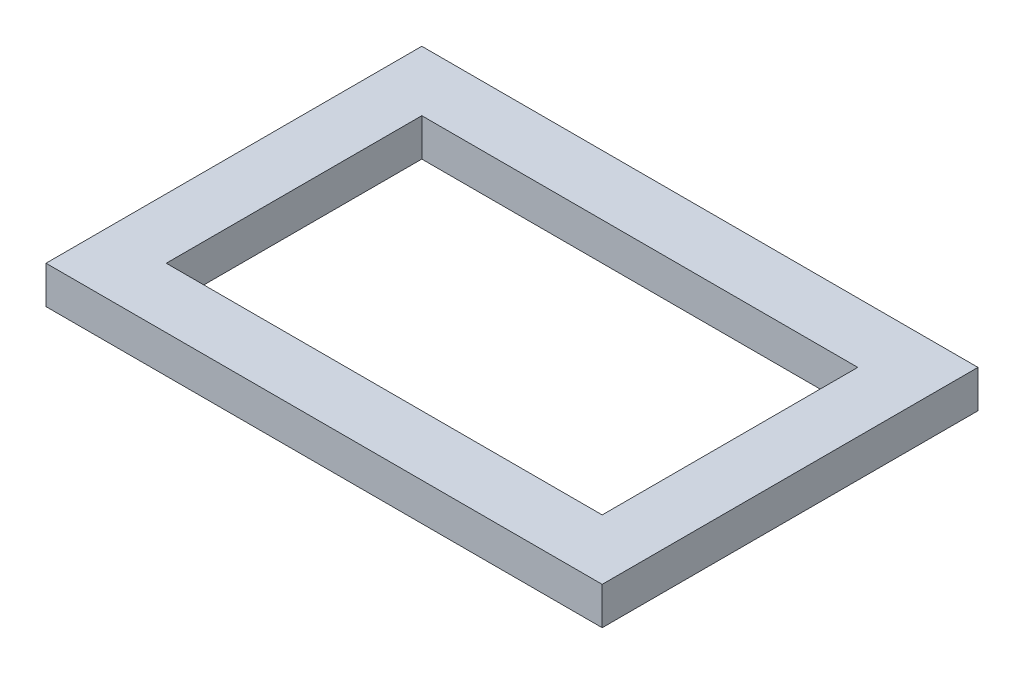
SolidWorks part; units mm, degrees
ref_plane "Front Plane" through (0, 0, 0) normal (0, 0, 1) x (1, 0, 0)
ref_plane "Top Plane" through (0, 0, 0) normal (0, 1, 0) x (1, 0, 0)
ref_plane "Right Plane" through (0, 0, 0) normal (1, 0, 0) x (0, 0, -1)
sketch "Sketch1" plane through (0, 0, 0) normal (0, 1, 0) x (1, 0, 0)
  line L0 (-117.475, 79.375) -> (117.475, 79.375)
  line L1 (-92.075, -53.975) -> (92.075, -53.975)
  line L2 (-92.075, -53.975) -> (-92.075, 53.975)
  line L3 (-92.075, 53.975) -> (92.075, 53.975)
  line L4 (92.075, -53.975) -> (92.075, 53.975)
  line L5 (-92.075, -53.975) -> (92.075, 53.975) construction
  line L6 (-92.075, 53.975) -> (92.075, -53.975) construction
  line L7 (117.475, -79.375) -> (117.475, 79.375)
  line L8 (-117.475, -79.375) -> (117.475, -79.375)
  line L9 (-117.475, -79.375) -> (-117.475, 79.375)
  point P0 (0, 0)
  dimension "D1" = 184.15
  dimension "D2" = 107.95
  dimension "D3" = 25.4
extrude "Boss-Extrude1" add sketch "Sketch1" along normal blind 15.88
